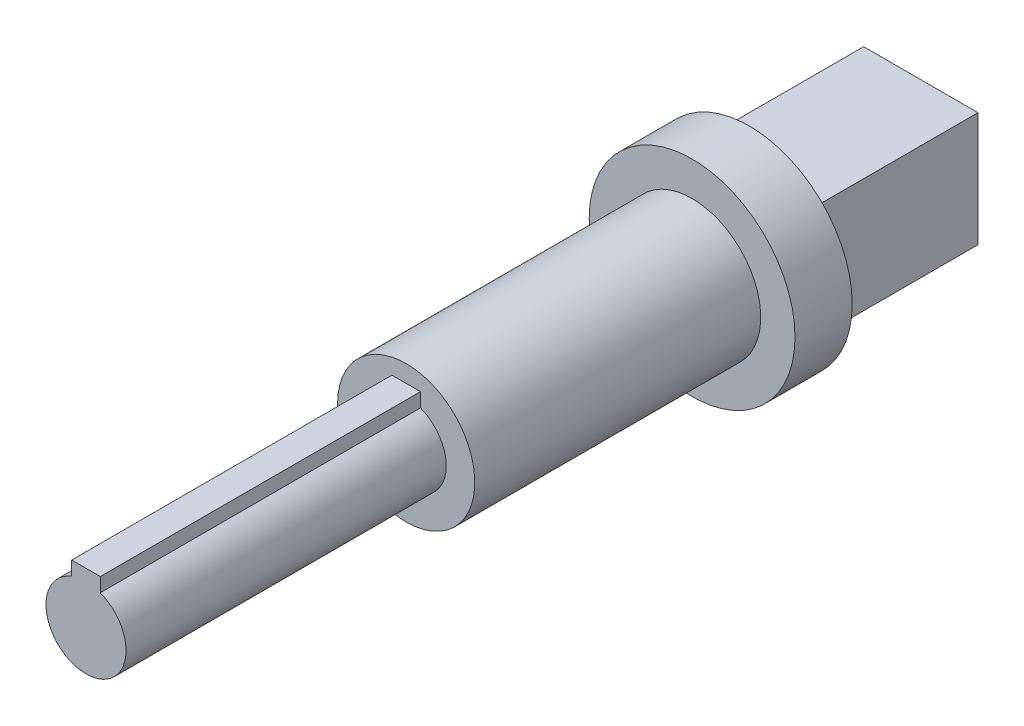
SolidWorks part; units mm, degrees
ref_plane "Front Plane" through (0, 0, 0) normal (0, 0, 1) x (1, 0, 0)
ref_plane "Top Plane" through (0, 0, 0) normal (0, 1, 0) x (1, 0, 0)
ref_plane "Right Plane" through (0, 0, 0) normal (1, 0, 0) x (0, 0, -1)
sketch "Sketch1" plane through (0, 0, 0) normal (0, 0, 1) x (1, 0, 0)
  circle A0 centre (0, 0) radius 152.4
  dimension "D1" = 304.8
extrude "Boss-Extrude1" add sketch "Sketch1" along normal mid plane 635
sketch "Sketch2" plane through (0, 0, -317.5) normal (0, 0, 1) x (1, 0, 0)
  circle A0 centre (0, 0) radius 228.6
  dimension "D1" = 457.2
extrude "Boss-Extrude2" add sketch "Sketch2" against normal blind 127
sketch "Sketch3" plane through (0, 0, -444.5) normal (0, 0, -1) x (-1, 0, 0)
  line L9 (-127, -127) -> (127, -127)
  line L10 (-127, -127) -> (-127, 127)
  line L11 (-127, 127) -> (127, 127)
  line L12 (127, -127) -> (127, 127)
  line L13 (-127, -127) -> (127, 127) construction
  line L14 (-127, 127) -> (127, -127) construction
  point P0 (0, 0)
  dimension "D1" = 254
  dimension "D2" = 254
extrude "Boss-Extrude3" add sketch "Sketch3" along normal blind 381
sketch "Sketch4" plane through (0, 0, 317.5) normal (0, 0, -1) x (-1, 0, 0)
  circle A0 centre (0, 0) radius 88.9
  dimension "D1" = 177.8
extrude "Boss-Extrude4" add sketch "Sketch4" against normal blind 711.2
sketch "Sketch5" plane through (0, 0, 1028.7) normal (0, 0, 1) x (1, 0, 0)
  line L0 (0, 0) -> (0, 137.9315) construction
  line L1 (-31.75, 114.3) -> (31.75, 114.3)
  line L2 (-31.75, 114.3) -> (-31.75, 83.037)
  line L4 (31.75, 114.3) -> (31.75, 83.037)
  circle A0 centre (0, 0) radius 88.9 construction
  arc A1 (31.75, 83.037) -> (-31.75, 83.037) centre (0, 0) ccw
  dimension "D1" = 114.3
  dimension "D2" = 63.5
extrude "Boss-Extrude5" add sketch "Sketch5" against normal up to surface (711.2 mm away)
